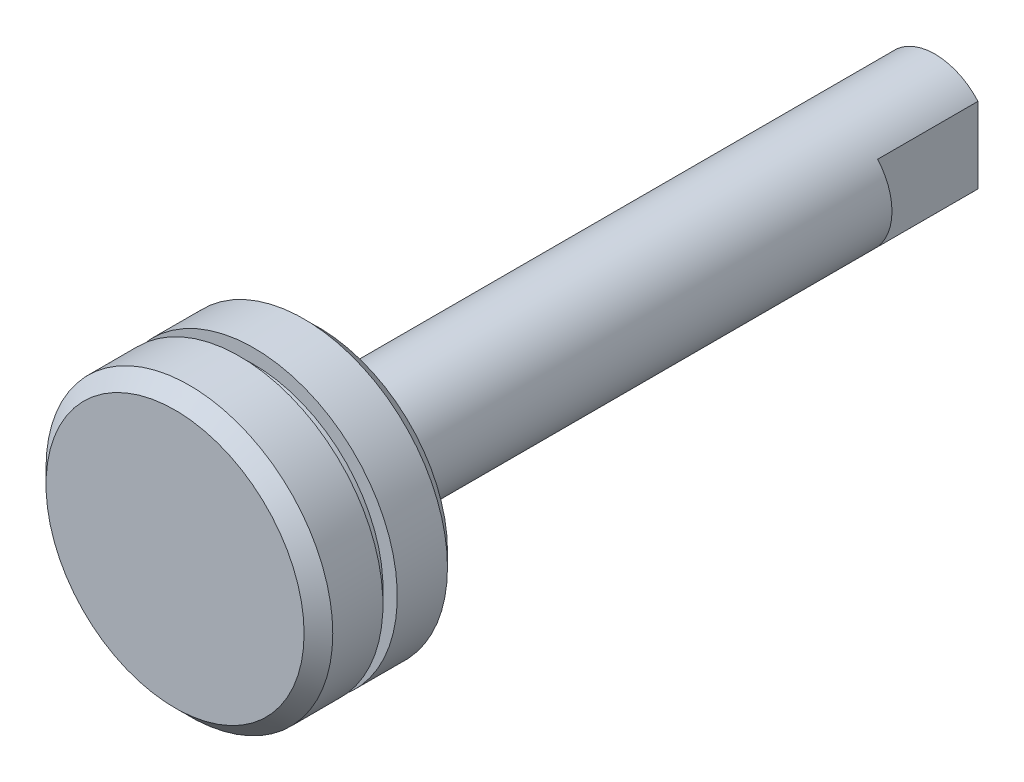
SolidWorks part; units mm, degrees
ref_plane "Plane1" through (0, 0, 0) normal (0, 0, 1) x (1, 0, 0)
ref_plane "Plane2" through (0, 0, 0) normal (0, 1, 0) x (1, 0, 0)
ref_plane "Plane3" through (0, 0, 0) normal (1, 0, 0) x (0, 0, -1)
sketch "Esquisse1" plane through (0, 0, 0) normal (0, 0, 1) x (1, 0, 0)
  circle A0 centre (0, 0) radius 4
  dimension "D1" = 8
extrude "Base-Extrusion" add sketch "Esquisse1" along normal blind 43
sketch "Esquisse2" plane through (0, 0, 43) normal (0, 0, 1) x (1, 0, 0)
  circle A0 centre (0, 0) radius 10
  dimension "D1" = 20
extrude "Boss.-Extru.1" add sketch "Esquisse2" along normal blind 10
sketch "Esquisse4" plane through (0, 0, 0) normal (0, 0, -1) x (-1, 0, 0)
  line L1 (3, 4.1026) -> (6.3142, 4.1026)
  line L2 (3, 4.1026) -> (3, -3.9095)
  line L3 (3, -3.9095) -> (6.3142, -3.9095)
  line L4 (6.3142, 4.1026) -> (6.3142, -3.9095)
  line L5 (-3, 4.1026) -> (-6.0568, 4.1026)
  line L6 (-3, 4.1026) -> (-3, -4.1669)
  line L7 (-3, -4.1669) -> (-6.0568, -4.1669)
  line L8 (-6.0568, 4.1026) -> (-6.0568, -4.1669)
  dimension "D1" = 3
  dimension "D2" = 3
extrude "Enlèv. mat.-Extru.1" cut sketch "Esquisse4" against normal blind 7
chamfer "Chanfrein2" distance 1 angle 45 2 edges at (10, 0, 53) (10, 0, 43)
sketch "Esquisse6" plane through (0, 0, 0) normal (1, 0, 0) x (0, 0, -1)
  line L0 (-53, 9) -> (-53, -9) construction
  line L1 (-48.5, 10) -> (-47.5, 10)
  line L2 (-48.5, 10) -> (-48.5, 9)
  line L3 (-48.5, 9) -> (-47.5, 9)
  line L4 (-47.5, 10) -> (-47.5, 9)
  line L5 (-44, 10) -> (-52, 10) construction
  line L6 (-53, 0) -> (-56.4888, 0) construction
  dimension "D1" = 1
  dimension "D2" = 1
  dimension "D3" = 4.5
revolve "Enlèvement de matière-Révolution2" cut sketch "Esquisse6" angle 360 about L6
hole_wizard "Trou taraudé M5x0.81" positions "Esquisse9" profile "Esquisse8" tap size "M5x0.8" standard "Ansi Métrique"
sketch "Esquisse9" plane through (0, 0, 0) normal (0, 0, -1) x (-1, 0, 0)
  point P0 (0, 0)
sketch "Esquisse8" plane through (0, 0, 0) normal (1, 0, 0) x (0, 1, 0)
  line L0 (0, 0) -> (0, 20.2618)
  line L1 (0, 20.2618) -> (2.1, 19)
  line L2 (2.1, 19) -> (2.1, 0)
  line L5 (2.1, 0) -> (0, 0)
  line L10 (0, 20.2618) -> (-2.1, 19) construction
  line L11 (0, -6.35) -> (0, 107.95) construction
  dimension "Diamètre du trou pour taraudage" = 4.2
  dimension "Profondeur du trou pour taraudage" = 19
  dimension "Angle de pointe" = 118
sketch "Esquisse10" plane through (0, 0, 43) normal (0, 0, -1) x (-1, 0, 0)
  circle A0 centre (0, 0) radius 7.5
  circle A1 centre (0, 0) radius 6.5
  dimension "D1" = 15
  dimension "D2" = 13
extrude "Enlèv. mat.-Extru.2" cut sketch "Esquisse10" against normal blind 2
